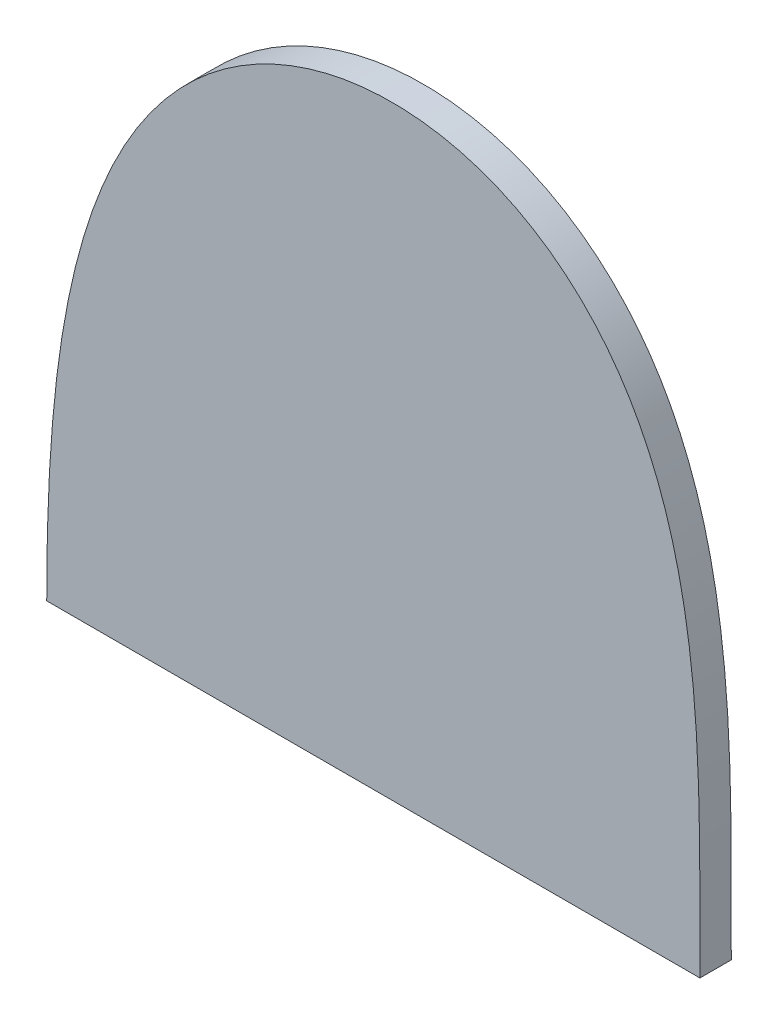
SolidWorks part; units mm, degrees
ref_plane "Front Plane" through (0, 0, 0) normal (0, 0, 1) x (1, 0, 0)
ref_plane "Top Plane" through (0, 0, 0) normal (0, 1, 0) x (1, 0, 0)
ref_plane "Right Plane" through (0, 0, 0) normal (1, 0, 0) x (0, 0, -1)
sketch "Sketch1" plane through (0, 0, 0) normal (0, 0, 1) x (1, 0, 0)
  line L0 (0, 0) -> (25.4, 0)
  line L1 (0, 0) -> (0, 15.0656) construction
  line L2 (0, 15.0656) -> (2.3849, 24.9295) construction
  line L3 (2.3849, 24.9295) -> (12.7, 28.7883) construction
  line L4 (12.7, 28.7883) -> (26.1367, 24.9295) construction
  line L5 (26.1367, 24.9295) -> (25.4, 15.0656) construction
  line L6 (25.4, 15.0656) -> (25.4, 0) construction
  spline_without_curve S0
  point P16 (12.7, 0)
  dimension "D1" = 25.4
base flange "Base-Flange1" sketch "Sketch1" thickness 1.2192 reverse thickness direction no parameters "D1"=0.7366
scale "Scale1" scale about centroid uniform scaling yes scale factor 0.5
sketch "Bend-Lines1" [suppressed] plane through (0, 0, 0) normal (0, 1, 0) x (1, 0, 0)
sketch "Bounding-Box1" [suppressed] plane through (0, 0, 0) normal (0, 1, 0) x (1, 0, 0)
sheet metal parameters "Sheet-Metal1" thickness 1.2192 parameters "D1"=0.7366
flat pattern "Flat-Pattern1"
sketch "Bend-Lines2" plane through (0, 0, 0) normal (0, 1, 0) x (1, 0, 0)
sketch3d "Bounding-Box2" [suppressed]
  line L0 (-13.4316, -23.5068, 0) -> (11.9708, -23.5068, 0) construction
  line L1 (-13.4316, 0, 0) -> (11.9708, 0, 0) construction
  line L2 (-13.4316, -23.5068, 0) -> (-13.4316, 0, 0) construction
  line L3 (11.9708, -23.5068, 0) -> (11.9708, 0, 0) construction
sheet metal parameters "Sheet-Metal2" thickness 1.2192 parameters "D1"=0.7366
flat pattern "Flat-Pattern1"
sketch "Bend-Lines2" plane through (0, 0, 0) normal (0, 1, 0) x (1, 0, 0)
sketch3d "Bounding-Box2" [suppressed]
  line L0 (-13.4316, -23.5068, 0) -> (11.9708, -23.5068, 0) construction
  line L1 (-13.4316, 0, 0) -> (11.9708, 0, 0) construction
  line L2 (-13.4316, -23.5068, 0) -> (-13.4316, 0, 0) construction
  line L3 (11.9708, -23.5068, 0) -> (11.9708, 0, 0) construction
